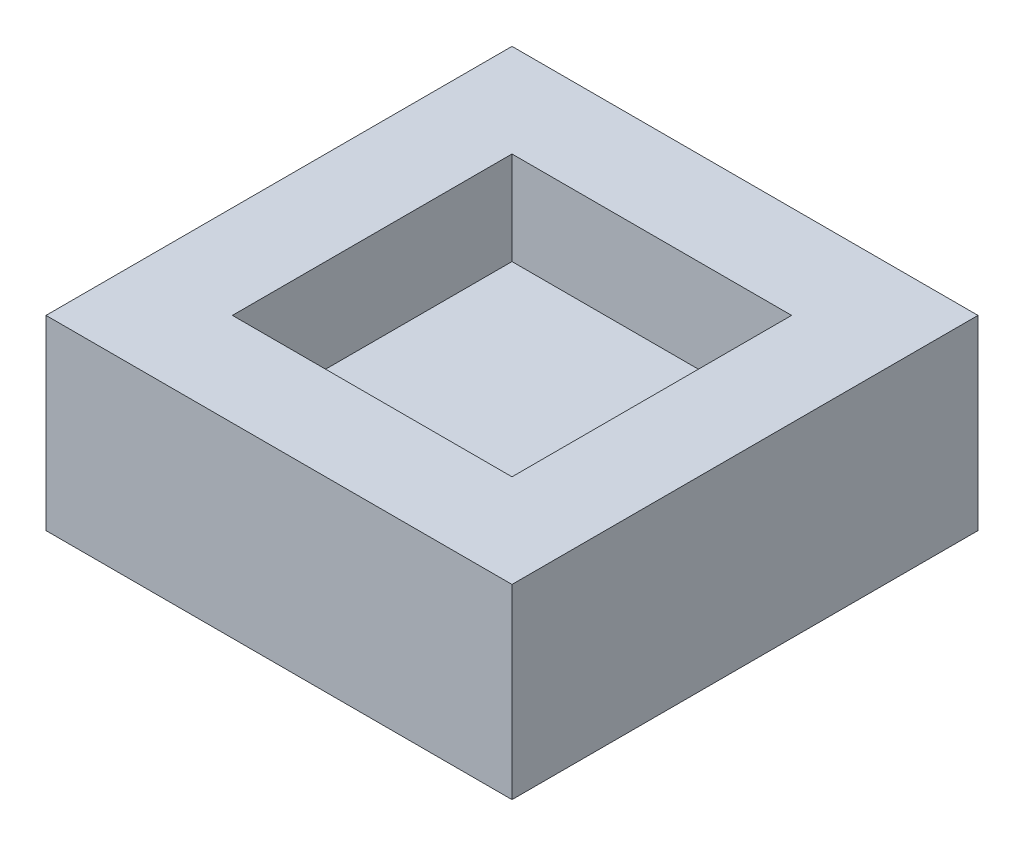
SolidWorks part; units mm, degrees
ref_plane "Front Plane" through (0, 0, 0) normal (0, 0, 1) x (1, 0, 0)
ref_plane "Top Plane" through (0, 0, 0) normal (0, 1, 0) x (1, 0, 0)
ref_plane "Right Plane" through (0, 0, 0) normal (1, 0, 0) x (0, 0, -1)
sketch "Sketch1" plane through (0, 0, 0) normal (0, 1, 0) x (1, 0, 0)
  line L1 (0, 0) -> (50, 0)
  line L2 (0, 0) -> (0, 50)
  line L3 (0, 50) -> (50, 50)
  line L4 (50, 0) -> (50, 50)
  dimension "D1" = 50
  dimension "D2" = 50
extrude "Extrude1" add sketch "Sketch1" along normal blind 20
sketch "Sketch2" plane through (0, 20, 0) normal (0, 1, 0) x (-1, 0, 0)
  line L10 (-10, -40) -> (-10, -10)
  line L11 (-10, -10) -> (-40, -10)
  line L12 (-40, -10) -> (-40, -40)
  line L13 (-40, -40) -> (-10, -40)
  line L14 (-10, -40) -> (-10, -10)
  line L15 (-10, -10) -> (-40, -10)
  line L16 (-40, -10) -> (-40, -40)
  line L17 (-40, -40) -> (-10, -40)
  dimension "D1" = 10
extrude "Cut-Extrude1" cut sketch "Sketch2" against normal blind 10
